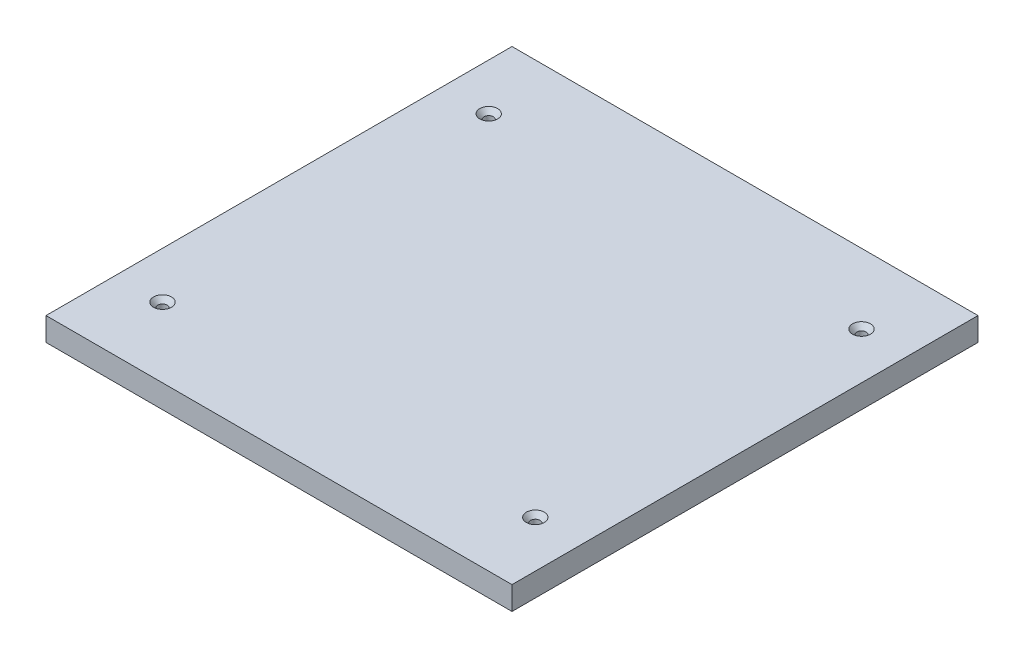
SolidWorks part; units mm, degrees
ref_plane "Front Plane" through (0, 0, 0) normal (0, 0, 1) x (1, 0, 0)
ref_plane "Top Plane" through (0, 0, 0) normal (0, 1, 0) x (1, 0, 0)
ref_plane "Right Plane" through (0, 0, 0) normal (1, 0, 0) x (0, 0, -1)
sketch "Sketch1" plane through (0, 0, 0) normal (0, 1, 0) x (1, 0, 0)
  line L1 (-127, 127) -> (127, 127)
  line L2 (-127, 127) -> (-127, -127)
  line L3 (-127, -127) -> (127, -127)
  line L4 (127, 127) -> (127, -127)
  line L5 (-127, 127) -> (127, -127) construction
  line L6 (-127, -127) -> (127, 127) construction
  point P0 (0, 0)
  dimension "D1" = 254
  dimension "D2" = 254
extrude "Boss-Extrude1" add sketch "Sketch1" along normal blind 12.7
sketch "Sketch2" plane through (0, 12.7, 0) normal (0, 1, 0) x (1, 0, 0)
  line L0 (127, 127) -> (-127, 127) construction
  line L2 (-101.6, 88.9) -> (101.6, 88.9) construction
  point P0 (-101.6, 88.9)
  point P1 (101.6, 88.9)
  point P2 (101.6, -88.9)
  point P3 (-101.6, -88.9)
  point P4 (0, 88.9)
  dimension "D1" = 38.1
  dimension "D2" = 177.8
  dimension "D3" = 203.2
hole_wizard "CSK for #10 Flat Head Machine Screw1" positions "3DSketch1" profile "Sketch3" countersink size "#10" standard "ANSI Inch"
sketch3d "3DSketch1"
  point P0 (-101.6, 12.7, -88.9)
  point P3 (101.6, 12.7, -88.9)
  point P6 (-101.6, 12.7, 88.9)
  point P9 (101.6, 12.7, 88.9)
sketch "Sketch3" plane through (-101.6, 12.7, -88.9) normal (1, 0, 0) x (0, 0, 1)
  line L0 (0, 0) -> (0, 12.7)
  line L1 (0, 12.7) -> (2.5527, 12.7)
  line L2 (2.5527, 12.7) -> (2.5527, 2.6882)
  line L3 (2.5527, 2.6882) -> (4.8895, 0)
  line L5 (4.8895, 0) -> (0, 0)
  line L6 (-2.5527, 2.6882) -> (-4.8895, 0) construction
  line L11 (0, -6.35) -> (0, 107.95) construction
  dimension "Thru Hole Dia." = 5.1054
  dimension "Thru Hole Depth" = 12.7
  dimension "Near C'Sink Dia." = 9.779
  dimension "Near C'Sink Angle" = 82
